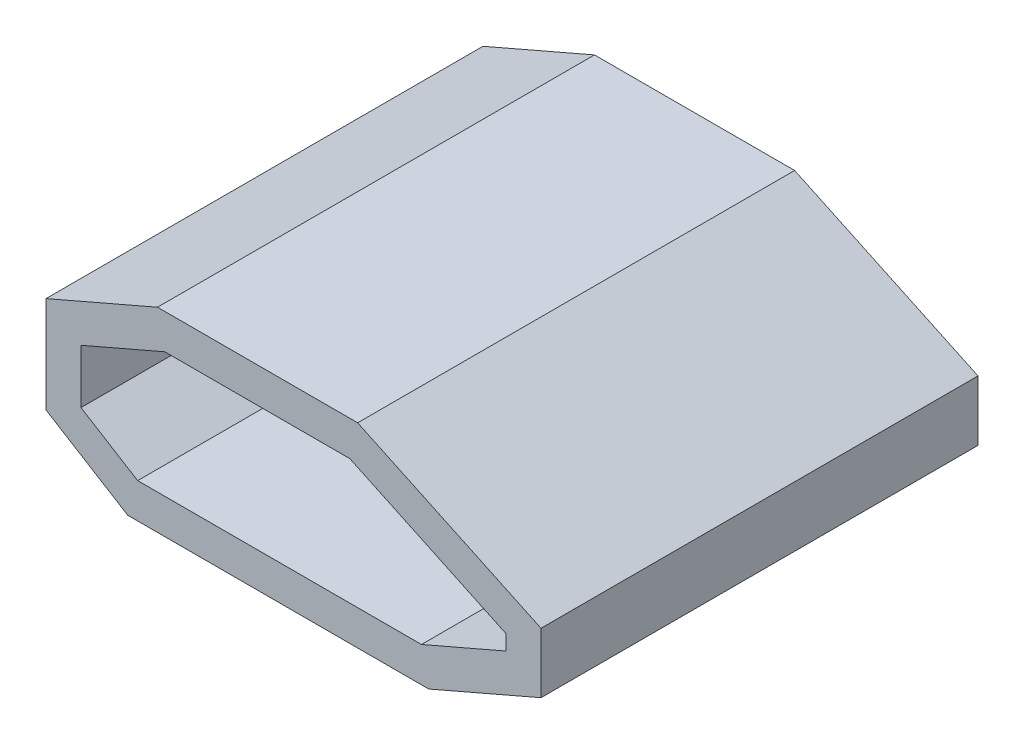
SolidWorks part; units mm, degrees
ref_plane "Front" through (0, 0, 0) normal (0, 0, 1) x (1, 0, 0)
ref_plane "Top" through (0, 0, 0) normal (0, 1, 0) x (1, 0, 0)
ref_plane "Right" through (0, 0, 0) normal (1, 0, 0) x (0, 0, -1)
sketch "Sketch1" plane through (0, 0, 0) normal (0, 0, 1) x (1, 0, 0)
  line L0 (0, 0) -> (0, 43.0308)
  line L1 (0, 43.0308) -> (55.8433, 67.2053)
  line L2 (55.8433, 67.2053) -> (166.0503, 67.2053)
  line L3 (166.0503, 67.2053) -> (263.1741, 21.5154)
  line L4 (263.1741, 21.5154) -> (263.1741, 0)
  line L5 (263.1741, 0) -> (206.8667, -24.3755)
  line L6 (206.8667, -24.3755) -> (39.6014, -24.3755)
  line L7 (39.6014, -24.3755) -> (0, 0)
extrude "Extrude-Thin1" add sketch "Sketch1" along normal mid plane 250 thin
